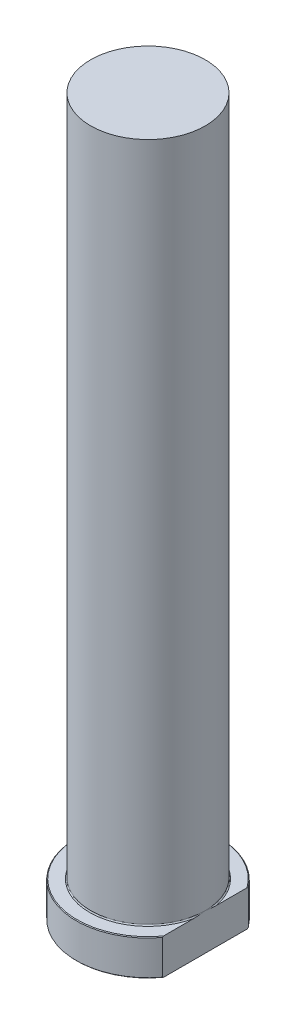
SolidWorks part; units mm, degrees
ref_plane "Front Plane" through (0, 0, 0) normal (0, 0, 1) x (1, 0, 0)
ref_plane "Top Plane" through (0, 0, 0) normal (0, 1, 0) x (1, 0, 0)
ref_plane "Right Plane" through (0, 0, 0) normal (1, 0, 0) x (0, 0, -1)
sketch "Sketch1" plane through (0, 0, 0) normal (0, 0, 1) x (1, 0, 0)
  line L0 (0, 259.9588) -> (0, -15.1925) construction
  line L1 (0, 0) -> (-20, 0)
  line L2 (-20, 0) -> (-20, 10)
  line L3 (-20, 10) -> (-16, 10)
  line L4 (-16, 10) -> (-16, 200)
  line L5 (-16, 200) -> (0, 200)
  line L6 (0, 200) -> (0, 0)
  dimension "L" = 200
  dimension "H" = 40
  dimension "T" = 10
  dimension "D" = 32
revolve "Revolve1" add sketch "Sketch1" angle 360 about L0
chamfer "Chamfer1" distance 0.2 angle 45 2 edges at (0, 10, 20) (0, 0, 20)
fillet "Fillet1" radius 0.3 1 edges at (0, 10, 16)
sketch "Sketch2" plane through (0, 0, 0) normal (0, 1, 0) x (1, 0, 0)
  line L0 (16, 12) -> (16, -12)
  circle A0 centre (0, 0) radius 20 construction
  arc A1 (16, -12) -> (16, 12) centre (0, 0) ccw
  circle A2 centre (0, 0) radius 16 construction
extrude "KEY" cut sketch "Sketch2" along normal through all
